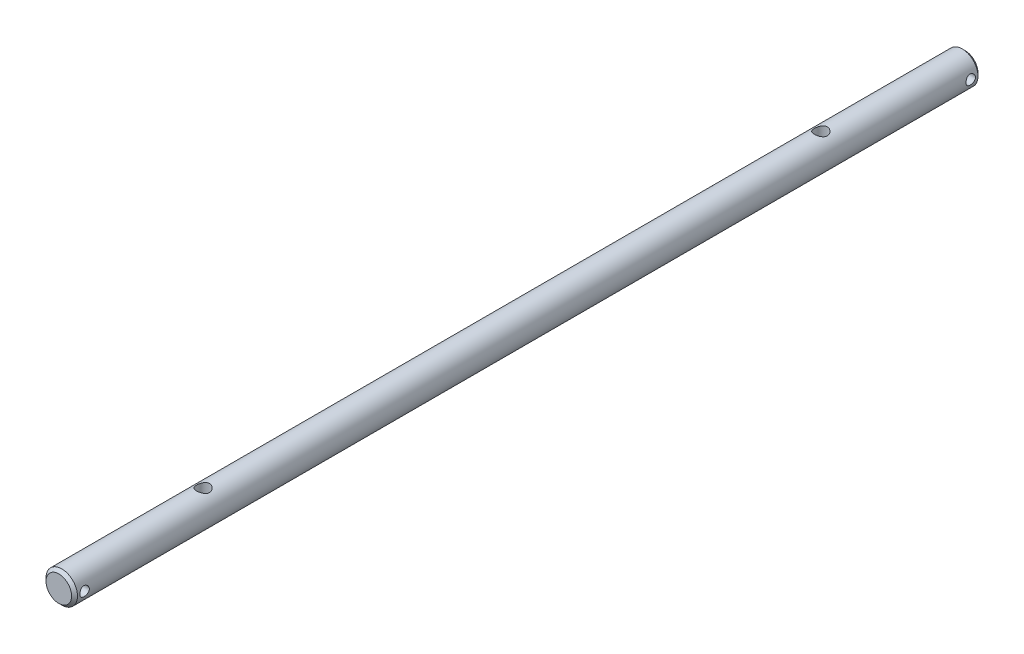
SolidWorks part; units mm, degrees
ref_plane "Plane1" through (0, 0, 0) normal (0, 0, 1) x (1, 0, 0)
ref_plane "Plane2" through (0, 0, 0) normal (0, 1, 0) x (1, 0, 0)
ref_plane "Plane3" through (0, 0, 0) normal (1, 0, 0) x (0, 0, -1)
sketch "Sketch1" plane through (0, 0, 0) normal (0, 0, 1) x (1, 0, 0)
  circle A0 centre (0, 0) radius 7.9375
  dimension "D1" = 15.875
extrude "rod" add sketch "Sketch1" along normal blind 457.2
sketch "Sketch2" plane through (0, 0, 0) normal (1, 0, 0) x (0, 0, -1)
  line L0 (-228.6, 7.9375) -> (-228.6, -56.4854) construction
  line L1 (0, -7.9375) -> (0, 7.9375) construction
  line L2 (0, 0) -> (-9.1652, 0) construction
  line L3 (-457.2, 0) -> (0, 0) construction
  line L4 (0, 7.9375) -> (-457.2, 7.9375) construction
  circle A0 centre (-5.08, 0.1505) radius 2.3812
  circle A1 centre (-452.12, 0.1505) radius 2.3813
  dimension "D2" = 4.7625
  dimension "D1" = 5.08
extrude "sprong retainer holes" cut sketch "Sketch2" against normal through all and the other way through all
sketch "Sketch3" plane through (0, 0, 0) normal (0, 1, 0) x (1, 0, 0)
  line L0 (-7.9375, -228.6) -> (76.8253, -228.6) construction
  line L1 (-7.9375, -7.4565) -> (-7.9375, -449.7435) construction
  line L2 (0, -457.2) -> (0, 0) construction
  line L3 (7.9375, 0) -> (-7.9375, 0) construction
  circle A0 centre (0, -72.771) radius 3.2639
  circle A1 centre (0, -384.429) radius 3.2639
  dimension "D1" = 6.5278
  dimension "D2" = 72.771
extrude "door holes" cut sketch "Sketch3" against normal through all and the other way through all
sketch "Sketch4" plane through (0, 0, 0) normal (0, 1, 0) x (1, 0, 0)
  line L0 (5.0853, 1.4339) -> (8.8043, -2.2851)
  line L1 (7.9375, 0) -> (-7.9375, 0) construction
  line L2 (5.0853, 1.4339) -> (8.8043, 1.4339)
  line L3 (8.8043, 1.4339) -> (12.3033, 1.4339)
  line L4 (8.8043, -458.5697) -> (13.634, -458.5697)
  line L6 (13.634, -458.5697) -> (13.634, 1.4339)
  line L7 (5.0853, -458.5697) -> (8.8043, -458.5697)
  line L8 (30.5851, -228.5679) -> (-72.5999, -228.5679) construction
  line L9 (5.0853, -458.5697) -> (8.8043, -454.8507)
  line L10 (8.8043, -2.2851) -> (8.8043, -454.8507)
  line L11 (12.3033, 1.4339) -> (13.634, 1.4339)
  line L12 (0, 0) -> (0, 13.6704) construction
  line L13 (0, -457.2) -> (0, 0) construction
  dimension "D1" = 45
revolve "Cut-Revolve1" cut sketch "Sketch4" angle 360 about L12
